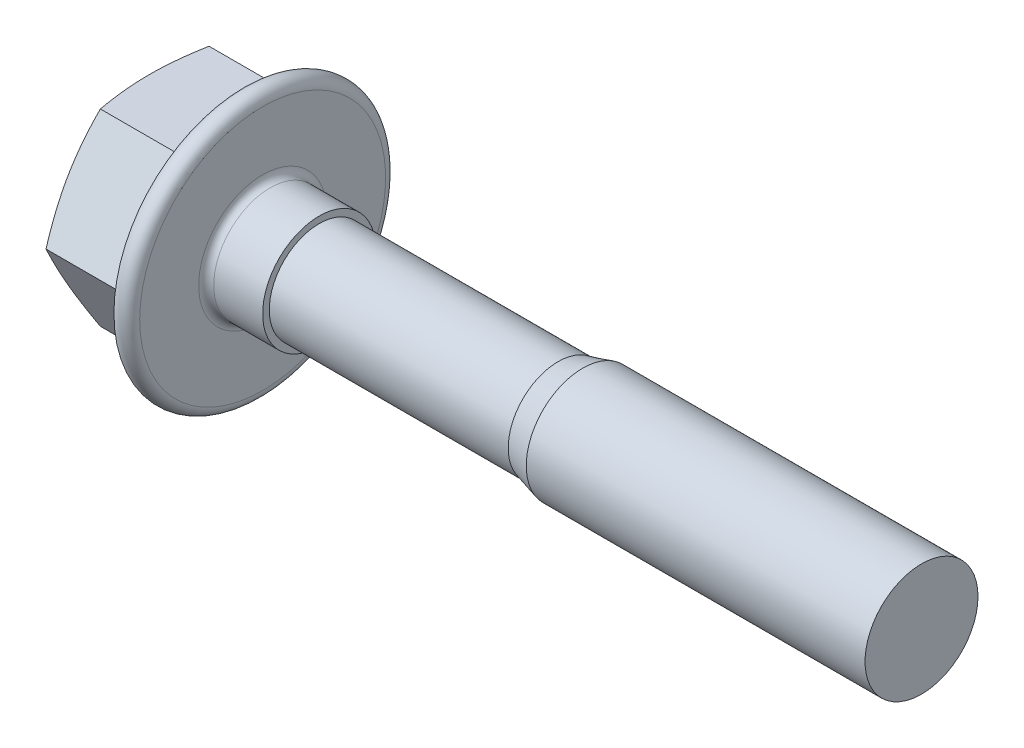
SolidWorks part; units mm, degrees
ref_plane "Front" through (0, 0, 0) normal (0, 0, 1) x (1, 0, 0)
ref_plane "Top" through (0, 0, 0) normal (0, 1, 0) x (1, 0, 0)
ref_plane "Right" through (0, 0, 0) normal (1, 0, 0) x (0, 0, -1)
sketch "Sketch1" plane through (0, 0, 0) normal (1, 0, 0) x (0, 0, -1)
  line L1 (5.7735, 0) -> (2.8868, 5)
  line L2 (2.8868, 5) -> (-2.8868, 5)
  line L3 (-2.8868, 5) -> (-5.7735, 0)
  line L4 (-5.7735, 0) -> (-2.8868, -5)
  line L5 (-2.8868, -5) -> (2.8868, -5)
  line L6 (2.8868, -5) -> (5.7735, 0)
  circle A0 centre (0, 0) radius 5 construction
  dimension "s" = 10
extrude "BaseHead" add sketch "Sketch1" along normal blind 6.6
sketch "Sketch2" plane through (6.6, 0, 0) normal (1, 0, 0) x (0, 0, -1)
  circle A0 centre (0, 0) radius 3
  dimension "d" = 6
extrude "BaseBody" add sketch "Sketch2" along normal blind 35
sketch "Sketch3" plane through (2.9494, 0, 2.8241) normal (0, 1, 0) x (0, 0, -1)
  line L0 (8.5976, 2.9494) -> (8.5976, 2.0855)
  line L2 (8.5976, 2.0855) -> (6.2241, 2.9494)
  line L4 (6.2241, 2.9494) -> (8.5976, 2.9494)
  line L5 (2.8241, 3.9387) -> (2.8241, 2.4525) construction
  dimension "D1" = 20
  dimension "da" = 6.8
revolve "HeadChamfer" cut sketch "Sketch3" angle 360 about L5
sketch "Sketch5" plane through (-0.1752, 0, 7.2752) normal (0, 1, 0) x (0, 0, -1)
  line L0 (7.2752, -6.7752) -> (7.2752, -7.1738) construction
  line L1 (7.2752, -41.7752) -> (7.2752, -6.7752) construction
  line L2 (7.2752, -6.7752) -> (13.8081, -6.7752)
  line L3 (14.002, -5.6752) -> (7.2752, -3.2268)
  line L4 (7.2752, -3.2268) -> (7.2752, -6.7752)
  line L5 (13.0487, -6.7752) -> (10.1619, -6.7752) construction
  arc A0 (13.8081, -6.7752) -> (14.002, -5.6752) centre (13.8081, -6.2081) ccw
  dimension "D3" = 20
  dimension "c" = 1.1
  dimension "dc" = 14.2
revolve "Flange" add sketch "Sketch5" angle 360 about L0
fillet "FlangeHexFillet" radius 0.4 6 edges
sketch "Sketch6" plane through (-28.3278, 0, -3) normal (0, 1, 0) x (-1, 0, 0)
  line L0 (-37.9278, 6) -> (-37.9278, 5.65)
  line L1 (-34.9278, 9.5329) -> (-34.9278, -3.5329) construction
  line L2 (-37.9278, 5.65) -> (-50.6216, 5.65)
  line L3 (-50.6216, 5.65) -> (-51.9278, 6)
  line L4 (-51.9278, 6) -> (-37.9278, 6)
  line L5 (-34.9278, 6) -> (-69.9278, 6) construction
  line L6 (-48.9486, 3) -> (-26.9469, 3) construction
  line L7 (-69.9278, 3) -> (-34.9278, 3) construction
  dimension "D1" = 15
  dimension "1d" = 3
  dimension "lg" = 17
  dimension "dr" = 5.3
revolve "Cut-Revolve1" cut sketch "Sketch6" angle 360 about L6
fillet "Fillet1" radius 0.4 1 edges at (6.6, 0, -3)
sketch "Sketch7" plane through (0, 0, 0) normal (0, 1, 0) x (1, 0, 0)
  line L0 (41.3293, 3.5415) -> (41.8708, 3.5415)
  line L1 (41.8708, 3.5415) -> (41.8708, 3)
  line L2 (41.8708, 3) -> (41.6, 2.531)
  line L3 (41.6, 2.531) -> (41.3293, 3)
  line L4 (41.3293, 3) -> (41.3293, 3.5415)
  line L5 (41.6, -3) -> (41.6, 3) construction
  line L6 (41.6, 3) -> (23.6, 3) construction
  dimension "D1" = 0.5415
revolve "Cut-Revolve10" [suppressed] cut sketch "Sketch7" angle 360
pattern_linear "LPattern10" [suppressed] count 28
equation "\"1d@Sketch6\" = \"d@Sketch2\"*0.5"
equation "\"lg@Sketch6\" = \"l@BaseBody\"-\"b@ThreadCosmetic1\""
equation "\"D1@Sketch7\" =  ( \"d@Sketch2\" - \"D2@ThreadCosmetic1\" )  / 2"
equation "\"pitch@LPattern10\" = 1.2 * \"D1@Sketch7\""
equation "\"D1@LPattern10\" = \"b@ThreadCosmetic1\" / \"pitch@LPattern10\""
